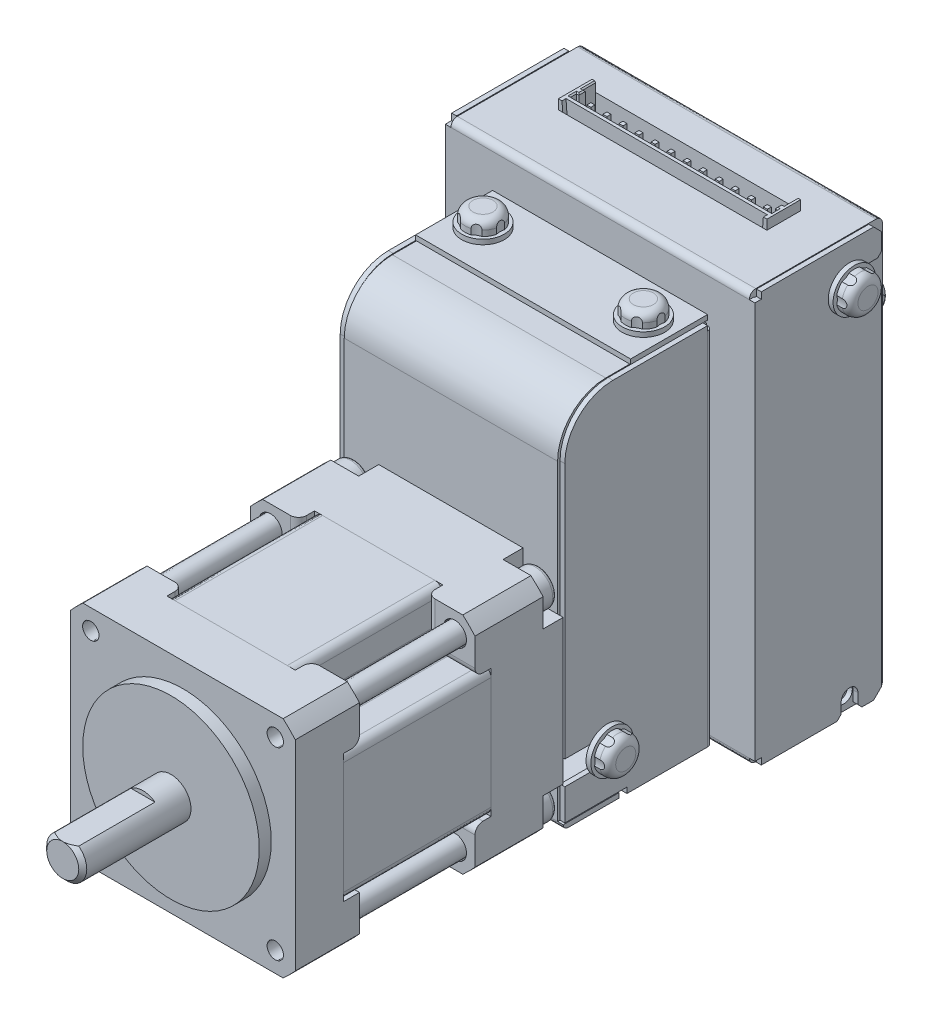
SolidWorks part; units mm, degrees
ref_plane "Front Plane" through (0, 0, 0) normal (0, 0, 1) x (1, 0, 0)
ref_plane "Top Plane" through (0, 0, 0) normal (0, 1, 0) x (1, 0, 0)
ref_plane "Right Plane" through (0, 0, 0) normal (1, 0, 0) x (0, 0, -1)
sketch "Sketch41" plane through (0, 0, 0) normal (0, 0, 1) x (1, 0, 0)
  circle A0 centre (0, 0) radius 11
  dimension "D1" = 22
extrude "Extrude21" add sketch "Sketch41" along normal blind 1.5
sketch "Sketch56" plane through (0, 0, 1.5) normal (0, 0, 1) x (1, 0, 0)
  circle A0 centre (0, 0) radius 2.5
  dimension "D1" = 5
extrude "Extrude33" add sketch "Sketch56" along normal blind 13.5
chamfer "Chamfer1" distance 0.5 angle 45
sketch "Sketch57" plane through (0, 0, 15) normal (0, 0, 1) x (1, 0, 0)
  line L0 (-1.5, 2) -> (1.5, 2)
  circle A0 centre (0, 0) radius 2.5 construction
  arc A1 (1.5, 2) -> (-1.5, 2) centre (0, 0) ccw
  dimension "D1" = 4.5
extrude "Cut-Extrude15" cut sketch "Sketch57" against normal blind 10
sketch "Sketch42" plane through (0, 0, 0) normal (0, 0, 1) x (1, 0, 0)
  line L1 (-12.48, 14) -> (12.48, 14)
  line L2 (-14, 12.48) -> (-14, -12.48)
  line L3 (-12.48, -14) -> (12.48, -14)
  line L4 (14, 12.48) -> (14, -12.48)
  line L6 (-14, 0) -> (14, 0) construction
  line L7 (0, 14) -> (0, -14) construction
  arc A0 (12.48, -14) -> (14, -12.48) centre (0, 0) ccw
  arc A1 (14, 12.48) -> (12.48, 14) centre (0, 0) ccw
  arc A2 (-12.48, 14) -> (-14, 12.48) centre (0, 0) ccw
  arc A3 (-14, -12.48) -> (-12.48, -14) centre (0, 0) ccw
  dimension "D3" = 37.51
  dimension "D1" = 28
  dimension "D2" = 28
extrude "Extrude22" add sketch "Sketch42" against normal blind 6 separate body
ref_plane "Length L" through (0, 0, -71) normal (0, 0, 1) x (1, 0, 0)
ref_plane "Plane10" through (0, 0, -52) normal (0, 0, 1) x (1, 0, 0)
ref_plane "Plane11" through (0, 0, -33.4) normal (0, 0, 1) x (1, 0, 0)
sketch "Sketch43" plane through (0, 0, -6) normal (0, 0, -1) x (-1, 0, 0)
  line L0 (-12.48, 14) -> (12.48, 14) construction
  line L1 (-8, 13) -> (-8, 10)
  line L2 (-10, 8) -> (-13, 8)
  line L3 (-14, -12.48) -> (-14, 12.48) construction
  line L4 (-14, 0) -> (14, 0) construction
  line L5 (14, 12.48) -> (14, -12.48) construction
  line L6 (0, 14) -> (0, -14) construction
  line L7 (12.48, -14) -> (-12.48, -14) construction
  line L8 (14, -12.48) -> (14, 12.48)
  line L9 (12.48, 14) -> (-12.48, 14)
  line L10 (-14, 12.48) -> (-14, -12.48)
  line L11 (-12.48, -14) -> (12.48, -14)
  line L12 (14, 12.48) -> (14, 8)
  line L13 (-7, 14) -> (-8, 14) construction
  line L14 (-14, 12.48) -> (-14, 8)
  line L15 (13, 8) -> (14, 8)
  line L16 (10, 8) -> (13, 8)
  line L17 (8, 13) -> (8, 10)
  line L18 (8, 14) -> (8, 13)
  line L19 (8, 14) -> (12.48, 14)
  line L20 (8, -14) -> (12.48, -14)
  line L21 (8, -14) -> (8, -13)
  line L22 (8, -13) -> (8, -10)
  line L23 (10, -8) -> (13, -8)
  line L24 (13, -8) -> (14, -8)
  line L25 (14, -12.48) -> (14, -8)
  line L26 (-8, 14) -> (-12.48, 14)
  line L27 (-14, 8) -> (-14, 7) construction
  line L28 (-8, 14) -> (-8, 13)
  line L29 (-13, 8) -> (-14, 8)
  line L30 (-14, -12.48) -> (-14, -8)
  line L31 (-13, -8) -> (-14, -8)
  line L32 (-10, -8) -> (-13, -8)
  line L33 (-8, -13) -> (-8, -10)
  line L34 (-8, -14) -> (-8, -13)
  line L35 (-8, -14) -> (-12.48, -14)
  arc A0 (-7, 14) -> (-8, 13) centre (-7, 13) ccw construction
  arc A1 (-8, 10) -> (-10, 8) centre (-10, 10) cw
  arc A2 (-13, 8) -> (-14, 7) centre (-13, 7) ccw construction
  arc A3 (8, 10) -> (10, 8) centre (10, 10) ccw
  arc A4 (12.48, 14) -> (14, 12.48) centre (0, 0) cw
  arc A5 (12.48, -14) -> (14, -12.48) centre (0, 0) ccw
  arc A6 (8, -10) -> (10, -8) centre (10, -10) cw
  arc A7 (12.48, -14) -> (14, -12.48) centre (0, 0) ccw
  arc A8 (14, 12.48) -> (12.48, 14) centre (0, 0) ccw
  arc A9 (-12.48, 14) -> (-14, 12.48) centre (0, 0) ccw
  arc A10 (-14, -12.48) -> (-12.48, -14) centre (0, 0) ccw
  arc A11 (-8, -10) -> (-10, -8) centre (-10, -10) ccw
  arc A12 (-12.48, -14) -> (-14, -12.48) centre (0, 0) cw
  arc A13 (-12.48, 14) -> (-14, 12.48) centre (0, 0) ccw
  dimension "D3" = 1
  dimension "D4" = 2
  dimension "D2" = 6
  dimension "D1" = 0
extrude "Extrude34" add sketch "Sketch43" along normal blind 2
hole_wizard "M2.5 Tapped Hole1" positions "Sketch59" profile "Sketch58" tap size "M2.5" standard "DIN"
sketch "Sketch59" plane through (0, 0, 0) normal (0, 0, 1) x (1, 0, 0)
  line L2 (11.5, 11.5) -> (-11.5, 11.5)
  line L3 (11.5, 11.5) -> (11.5, -11.5)
  line L4 (11.5, -11.5) -> (-11.5, -11.5)
  line L5 (-11.5, 11.5) -> (-11.5, -11.5)
  line L6 (11.5, 0) -> (-11.5, 0) construction
  line L8 (0, 11.5) -> (0, -11.5) construction
  point P87 (11.5, 11.5)
  point P89 (-11.5, 11.5)
  point P91 (11.5, -11.5)
  point P93 (-11.5, -11.5)
  dimension "D1" = 23
sketch "Sketch58" plane through (11.5, 11.5, 0) normal (1, 0, 0) x (0, -1, 0)
  line L0 (0, 0) -> (0, 8)
  line L1 (0, 8) -> (1.025, 8)
  line L2 (1.025, 8) -> (1.025, 0)
  line L5 (1.025, 0) -> (0, 0)
  line L11 (0, -6.35) -> (0, 107.95) construction
  dimension "Thru Tap Drill Dia." = 2.05
  dimension "Thru Tap Drill Depth" = 8
sketch "Sketch45" plane through (0, 0, -33.4) normal (0, 0, -1) x (-1, 0, 0)
  line L4 (-12.48, -14) -> (12.48, -14)
  line L5 (-14, 12.48) -> (-14, -12.48)
  line L6 (12.48, 14) -> (-12.48, 14)
  line L7 (14, -12.48) -> (14, 12.48)
  line L8 (-12.48, -14) -> (12.48, -14)
  line L9 (-14, 12.48) -> (-14, -12.48)
  line L10 (12.48, 14) -> (-12.48, 14)
  line L11 (14, -12.48) -> (14, 12.48)
  arc A4 (12.48, -14) -> (14, -12.48) centre (0, 0) ccw
  arc A5 (-14, -12.48) -> (-12.48, -14) centre (0, 0) ccw
  arc A6 (-12.48, 14) -> (-14, 12.48) centre (0, 0) ccw
  arc A7 (14, 12.48) -> (12.48, 14) centre (0, 0) ccw
  arc A8 (12.48, -14) -> (14, -12.48) centre (0, 0) ccw
  arc A9 (-14, -12.48) -> (-12.48, -14) centre (0, 0) ccw
  arc A10 (-12.48, 14) -> (-14, 12.48) centre (0, 0) ccw
  arc A11 (14, 12.48) -> (12.48, 14) centre (0, 0) ccw
  dimension "D1" = 0
extrude "Extrude24" add sketch "Sketch45" against normal blind 9 separate body
sketch "Sketch46" plane through (0, 0, -24.4) normal (0, 0, 1) x (1, 0, 0)
  line L4 (8, -14) -> (12.48, -14)
  line L5 (8, -10) -> (8, -14)
  line L6 (14, -8) -> (10, -8)
  line L7 (14, -12.48) -> (14, -8)
  line L8 (8, -14) -> (12.48, -14)
  line L9 (8, -10) -> (8, -14)
  line L10 (14, -8) -> (10, -8)
  line L11 (14, -12.48) -> (14, -8)
  line L12 (-14, -8) -> (-14, -12.48)
  line L13 (-10, -8) -> (-14, -8)
  line L14 (-8, -14) -> (-8, -10)
  line L15 (-12.48, -14) -> (-8, -14)
  line L16 (-14, -8) -> (-14, -12.48)
  line L17 (-10, -8) -> (-14, -8)
  line L18 (-8, -14) -> (-8, -10)
  line L19 (-12.48, -14) -> (-8, -14)
  line L20 (-8, 14) -> (-12.48, 14)
  line L21 (-8, 10) -> (-8, 14)
  line L22 (-14, 8) -> (-10, 8)
  line L23 (-14, 12.48) -> (-14, 8)
  line L24 (-8, 14) -> (-12.48, 14)
  line L25 (-8, 10) -> (-8, 14)
  line L26 (-14, 8) -> (-10, 8)
  line L27 (-14, 12.48) -> (-14, 8)
  line L28 (8, 14) -> (8, 10)
  line L29 (12.48, 14) -> (8, 14)
  line L30 (14, 8) -> (14, 12.48)
  line L31 (10, 8) -> (14, 8)
  line L32 (8, 14) -> (8, 10)
  line L33 (12.48, 14) -> (8, 14)
  line L34 (14, 8) -> (14, 12.48)
  line L35 (10, 8) -> (14, 8)
  arc A2 (12.48, -14) -> (14, -12.48) centre (0, 0) ccw
  arc A3 (10, -8) -> (8, -10) centre (10, -10) ccw
  arc A4 (12.48, -14) -> (14, -12.48) centre (0, 0) ccw
  arc A5 (10, -8) -> (8, -10) centre (10, -10) ccw
  arc A6 (-14, -12.48) -> (-12.48, -14) centre (0, 0) ccw
  arc A7 (-8, -10) -> (-10, -8) centre (-10, -10) ccw
  arc A8 (-14, -12.48) -> (-12.48, -14) centre (0, 0) ccw
  arc A9 (-8, -10) -> (-10, -8) centre (-10, -10) ccw
  arc A10 (-12.48, 14) -> (-14, 12.48) centre (0, 0) ccw
  arc A11 (-10, 8) -> (-8, 10) centre (-10, 10) ccw
  arc A12 (-12.48, 14) -> (-14, 12.48) centre (0, 0) ccw
  arc A13 (-10, 8) -> (-8, 10) centre (-10, 10) ccw
  arc A14 (14, 12.48) -> (12.48, 14) centre (0, 0) ccw
  arc A15 (8, 10) -> (10, 8) centre (10, 10) ccw
  arc A16 (14, 12.48) -> (12.48, 14) centre (0, 0) ccw
  arc A17 (8, 10) -> (10, 8) centre (10, 10) ccw
  dimension "D1" = 0
  dimension "D2" = 0
  dimension "D3" = 0
  dimension "D4" = 0
extrude "Extrude25" add sketch "Sketch46" along normal blind 2
hole_wizard "M2.5 Clearance Hole1" positions "Sketch61" profile "Sketch60" hole size "M2.5" standard "DIN"
sketch "Sketch61" plane through (0, 0, -33.4) normal (0, 0, -1) x (-1, 0, 0)
  point P34 (-11.5, -11.5)
  point P36 (-11.5, 11.5)
  point P38 (11.5, 11.5)
  point P40 (11.5, -11.5)
sketch "Sketch60" plane through (11.5, -11.5, -33.4) normal (1, 0, 0) x (0, 1, 0)
  line L0 (0, 0) -> (0, 48.4)
  line L1 (0, 48.4) -> (1.45, 48.4)
  line L2 (1.45, 48.4) -> (1.45, 0)
  line L5 (1.45, 0) -> (0, 0)
  line L11 (0, -6.35) -> (0, 107.95) construction
  dimension "Thru Hole Dia." = 2.9
  dimension "Thru Hole Depth" = 48.4
sketch "Sketch62" plane through (0, 0, -33.4) normal (0, 0, -1) x (-1, 0, 0)
  line L0 (-9, 14) -> (-9, 10)
  line L2 (-10, 9) -> (-14, 9)
  line L4 (-8.6938, 0) -> (8.6938, 0) construction
  line L5 (0, 8.2864) -> (0, -8.2864) construction
  line L6 (-9, 14) -> (-12.48, 14)
  line L7 (-14, 12.48) -> (-14, 9)
  line L8 (14, 12.48) -> (14, 9)
  line L9 (9, 14) -> (12.48, 14)
  line L10 (10, 9) -> (14, 9)
  line L11 (9, 14) -> (9, 10)
  line L12 (9, -14) -> (9, -10)
  line L13 (10, -9) -> (14, -9)
  line L14 (9, -14) -> (12.48, -14)
  line L15 (14, -12.48) -> (14, -9)
  line L16 (-14, -12.48) -> (-14, -9)
  line L17 (-9, -14) -> (-12.48, -14)
  line L18 (-10, -9) -> (-14, -9)
  line L19 (-9, -14) -> (-9, -10)
  line L20 (-14, 12.48) -> (-14, -12.48) construction
  arc A0 (-9, 10) -> (-10, 9) centre (-10, 10) cw
  arc A2 (-12.48, 14) -> (-14, 12.48) centre (0, 0) ccw
  arc A3 (12.48, 14) -> (14, 12.48) centre (0, 0) cw
  arc A4 (9, 10) -> (10, 9) centre (10, 10) ccw
  arc A5 (9, -10) -> (10, -9) centre (10, -10) cw
  arc A6 (12.48, -14) -> (14, -12.48) centre (0, 0) ccw
  arc A7 (-12.48, -14) -> (-14, -12.48) centre (0, 0) cw
  arc A8 (-9, -10) -> (-10, -9) centre (-10, -10) ccw
  dimension "D1" = 5
extrude "Cut-Extrude16" cut sketch "Sketch62" against normal blind 2.5
sketch "Sketch47" plane through (0, 0, -6) normal (0, 0, -1) x (-1, 0, 0)
  line L0 (-10, 8) -> (-13, 8) construction
  line L1 (-8, 13) -> (-8, 10) construction
  line L2 (-10, 8) -> (-13, 8)
  line L3 (-8, 13) -> (-8, 10)
  line L5 (-14, 0) -> (14, 0) construction
  line L6 (-14, 0) -> (14, 0) construction
  line L9 (0, 9.7532) -> (0, -9.7532) construction
  line L10 (8, 13) -> (8, 10)
  line L11 (10, 8) -> (13, 8)
  line L12 (10, -8) -> (13, -8)
  line L13 (8, -13) -> (8, -10)
  line L14 (-8, -13) -> (-8, -10)
  line L15 (-10, -8) -> (-13, -8)
  line L16 (-7, 14) -> (7, 14)
  line L17 (-14, 7) -> (-14, -7)
  line L18 (14, 7) -> (14, -7)
  line L19 (-7, -14) -> (7, -14)
  arc A0 (-10, 8) -> (-8, 10) centre (-10, 10) ccw construction
  arc A1 (-7, 14) -> (-8, 13) centre (-7, 13) ccw construction
  arc A2 (-13, 8) -> (-14, 7) centre (-13, 7) ccw construction
  arc A3 (-7, 14) -> (-8, 13) centre (-7, 13) ccw
  arc A4 (-13, 8) -> (-14, 7) centre (-13, 7) ccw
  arc A5 (-10, 8) -> (-8, 10) centre (-10, 10) ccw
  arc A6 (10, 8) -> (8, 10) centre (10, 10) cw
  arc A7 (13, 8) -> (14, 7) centre (13, 7) cw
  arc A8 (7, 14) -> (8, 13) centre (7, 13) cw
  arc A9 (7, -14) -> (8, -13) centre (7, -13) ccw
  arc A10 (13, -8) -> (14, -7) centre (13, -7) ccw
  arc A11 (10, -8) -> (8, -10) centre (10, -10) ccw
  arc A12 (-10, -8) -> (-8, -10) centre (-10, -10) cw
  arc A13 (-13, -8) -> (-14, -7) centre (-13, -7) cw
  arc A14 (-7, -14) -> (-8, -13) centre (-7, -13) cw
extrude "Extrude26" add sketch "Sketch47" along normal up to surface (18.4 mm away) separate body
fillet "Fillet26" radius 1
fillet "Fillet27" radius 1
sketch "Sketch48" plane through (0, 0, 0) normal (1, 0, 0) x (0, 0, -1)
  line L1 (33.4, 25.5) -> (33.4, -14)
  line L2 (39.4, 31.5) -> (52, 31.5)
  line L3 (52, 31.5) -> (52, -14)
  line L4 (33.4, -14) -> (51.3, -14)
  line L5 (51.4, 30.9) -> (51.4, -13.4)
  line L6 (39.4, 30.9) -> (51.4, 30.9)
  line L7 (34, 25.5) -> (34, -13.4)
  line L8 (34, -13.4) -> (51.3, -13.4)
  line L9 (33.4, -14) -> (51.4, -14) construction
  line L10 (52, 31.5) -> (52, -13.4) construction
  line L12 (52, 20.955) -> (52, -20.955) construction
  line L14 (22.4, -14) -> (30.9, -14) construction
  line L15 (33.4, -9) -> (33.4, 9) construction
  line L16 (22.4, 14) -> (30.9, 14) construction
  line L17 (51.3, -13.4) -> (51.3, -14)
  line L18 (34, -13.4) -> (51.4, -13.4) construction
  line L19 (51.4, -13.4) -> (51.4, -14)
  line L20 (51.4, -14) -> (52, -14)
  arc A0 (33.4, 25.5) -> (39.4, 31.5) centre (39.4, 25.5) cw
  arc A1 (34, 25.5) -> (39.4, 30.9) centre (39.4, 25.5) cw
  dimension "D2" = 6
  dimension "D3" = 17.5
  dimension "D4" = 0.1
  dimension "D1" = 0.6
extrude "Extrude27" add sketch "Sketch48" along normal mid plane 26.6 separate body
sketch "Sketch50" plane through (14, 0, 0) normal (1, 0, 0) x (0, 0, -1)
  line L0 (52, 31.5) -> (39.4, 31.5) construction
  line L3 (51.4, 31.5) -> (39.6, 31.5)
  line L4 (52, -14) -> (52, 30.9)
  line L5 (41.35, -14) -> (52, -14)
  line L6 (33.6, 25.5) -> (33.6, -6.4)
  line L7 (41.35, -14) -> (41.35, -13.3)
  line L9 (41.35, -13.3) -> (33.6, -13.3)
  line L11 (33.4, 25.5) -> (33.4, -14) construction
  line L12 (33.6, -9.4) -> (38.9, -9.4)
  line L13 (38.9, -6.4) -> (33.6, -6.4)
  line L14 (33.6, -9.4) -> (33.6, -13.3)
  line L15 (51.4, -14) -> (51.4, 30.9) construction
  line L16 (51.4, 31.5) -> (51.4, 30.9)
  line L17 (51.4, 30.9) -> (39.4, 30.9) construction
  line L18 (51.4, 30.9) -> (52, 30.9)
  arc A0 (33.6, 25.5) -> (39.6, 31.5) centre (39.6, 25.5) cw
  arc A1 (38.9, -9.4) -> (38.9, -6.4) centre (38.9, -7.9) ccw
  dimension "D1" = 6
  dimension "D2" = 0.7
  dimension "D3" = 7.95
  dimension "D4" = 0.2
  dimension "D5" = 3
  dimension "D6" = 5.3
  dimension "D7" = 6.1
extrude "Extrude28" add sketch "Sketch50" against normal blind 0.6
sketch "Sketch51" plane through (13.3, 0, 0) normal (1, 0, 0) x (0, 0, -1)
  line L0 (52, -14) -> (52, 31.5) construction
  line L2 (52, -14) -> (52, 30.9)
  line L3 (52, 30.9) -> (51.4, 30.9)
  line L4 (51.4, -14) -> (51.4, 30.9) construction
  line L5 (51.4, -14) -> (51.4, 30.9)
  line L7 (51.4, -14) -> (52, -14)
  line L8 (52, 30.9) -> (51.4, 30.9) construction
extrude "Extrude29" add sketch "Sketch51" along normal up to surface (0.1 mm away)
sketch "Sketch52" plane through (-14, 0, 0) normal (-1, 0, 0) x (0, 0, 1)
  line L6 (-52, 30.9) -> (-52, -14)
  line L7 (-39.6, 31.5) -> (-51.4, 31.5)
  line L8 (-33.6, -6.4) -> (-33.6, 25.5)
  line L9 (-41.35, -13.3) -> (-33.6, -13.3)
  line L10 (-41.35, -14) -> (-41.35, -13.3)
  line L11 (-52, -14) -> (-41.35, -14)
  line L12 (-52, 30.9) -> (-52, -14)
  line L13 (-39.6, 31.5) -> (-51.4, 31.5)
  line L14 (-33.6, -13.3) -> (-33.6, 25.5)
  line L15 (-41.35, -13.3) -> (-33.6, -13.3)
  line L16 (-41.35, -14) -> (-41.35, -13.3)
  line L17 (-52, -14) -> (-41.35, -14)
  line L21 (-38.9, -6.4) -> (-33.6, -6.4)
  line L23 (-33.6, -9.4) -> (-38.9, -9.4)
  line L25 (-33.6, -13.3) -> (-33.6, -9.4)
  line L26 (-51.4, 30.9) -> (-52, 30.9)
  line L27 (-51.4, 30.9) -> (-52, 30.9)
  line L28 (-51.4, 31.5) -> (-51.4, 30.9)
  line L29 (-51.4, 31.5) -> (-51.4, 30.9)
  arc A1 (-33.6, 25.5) -> (-39.6, 31.5) centre (-39.6, 25.5) ccw
  arc A2 (-33.6, 25.5) -> (-39.6, 31.5) centre (-39.6, 25.5) ccw
  arc A4 (-38.9, -6.4) -> (-38.9, -9.4) centre (-38.9, -7.9) ccw
  dimension "D1" = 0
extrude "Extrude30" add sketch "Sketch52" against normal blind 0.6
sketch "Sketch53" plane through (-13.3, 0, 0) normal (-1, 0, 0) x (0, 0, 1)
  line L4 (-52, 30.9) -> (-52, -14)
  line L5 (-51.4, 30.9) -> (-52, 30.9)
  line L6 (-51.4, -14) -> (-51.4, 30.9)
  line L7 (-52, -14) -> (-51.4, -14)
  line L8 (-52, 30.9) -> (-52, -14)
  line L9 (-51.4, 30.9) -> (-52, 30.9)
  line L10 (-51.4, -14) -> (-51.4, 30.9)
  line L11 (-52, -14) -> (-51.4, -14)
  dimension "D1" = 0
extrude "Extrude31" add sketch "Sketch53" along normal up to surface (0.1 mm away)
fillet "Fillet24" radius 0.6 1 edges at (-14, 8.45, -52)
sketch "Sketch55" plane through (0, 0, 0) normal (1, 0, 0) x (0, 0, -1)
  line L0 (33.4, 25.5) -> (33.4, -14) construction
  line L1 (34, -13.4) -> (51.3, -13.4) construction
  line L2 (33.4, -14) -> (51.3, -14) construction
  line L3 (33.4, -13.4) -> (33.4, -14)
  line L4 (33.4, -13.4) -> (40.35, -13.4)
  line L5 (33.4, -14) -> (40.35, -14)
  line L6 (40.35, -14) -> (40.35, -13.4)
  dimension "D1" = 6.95
extrude "Extrude32" add sketch "Sketch55" along normal up to surface and the other way up to surface
fillet "Fillet25" radius 0.6 1 edges at (0, -14, -33.4)
fillet "Fillet30" radius 0.6
sketch "Sketch63" plane through (0, 0, -8) normal (0, 0, -1) x (-1, 0, 0)
  circle A0 centre (-11.5, 11.5) radius 1.3
  circle A1 centre (11.5, 11.5) radius 1.3
  circle A2 centre (-11.5, -11.5) radius 1.3
  circle A3 centre (11.5, -11.5) radius 1.3
  dimension "D1" = 2.6
extrude "Extrude35" add sketch "Sketch63" against normal blind 5 and the other way up to surface separate body
sketch "Sketch64" plane through (0, 0, -30.9) normal (0, 0, -1) x (-1, 0, 0)
  circle A0 centre (-11.5, -11.5) radius 2.2
  circle A1 centre (-11.5, 11.5) radius 2.2
  circle A2 centre (11.5, 11.5) radius 2.2
  circle A3 centre (11.5, -11.5) radius 2.2
  dimension "D1" = 4.4
extrude "Extrude36" add sketch "Sketch64" along normal blind 2 separate body
fillet "Fillet31" radius 0.5 1 edges at (-13.7, 11.5, -32.9)
fillet "Fillet32" radius 0.5
fillet "Fillet33" radius 0.5
fillet "Fillet34" radius 0.5
sketch "Sketch65" plane through (14, 0, 0) normal (1, 0, 0) x (0, 0, -1)
  circle A0 centre (38.9, -7.9) radius 2.65
  dimension "D1" = 5.3
extrude "Extrude37" add sketch "Sketch65" along normal blind 0.6 separate body
sketch "Sketch66" plane through (14.6, 0, 0) normal (1, 0, 0) x (0, 0, -1)
  circle A0 centre (38.9, -7.9) radius 2.25
  dimension "D1" = 4.5
extrude "Extrude38" add sketch "Sketch66" along normal blind 1.7 separate body
fillet "Fillet35" radius 1 1 edges at (16.3, -5.65, -38.9)
sketch "Sketch67" plane through (16.3, 0, 0) normal (1, 0, 0) x (0, 0, -1)
  line L0 (36.78, -7.9) -> (36.65, -7.9) construction
  line L1 (40.835, -4.5485) -> (36.965, -4.5485) construction
  line L2 (36.965, -4.5485) -> (35.03, -7.9) construction
  line L3 (35.03, -7.9) -> (36.965, -11.2515) construction
  line L4 (36.965, -11.2515) -> (40.835, -11.2515) construction
  line L5 (40.835, -11.2515) -> (42.77, -7.9) construction
  line L6 (42.77, -7.9) -> (40.835, -4.5485) construction
  circle A0 centre (38.9, -7.9) radius 3.3515 construction
  circle A1 centre (42.77, -7.9) radius 1.75
  circle A2 centre (40.835, -4.5485) radius 1.75
  circle A3 centre (36.965, -4.5485) radius 1.75
  circle A4 centre (35.03, -7.9) radius 1.75
  circle A5 centre (36.965, -11.2515) radius 1.75
  circle A6 centre (40.835, -11.2515) radius 1.75
  circle A7 centre (38.9, -7.9) radius 2.25 construction
  dimension "D1" = 3.5
  dimension "D2" = 0.13
extrude "Cut-Extrude17" cut sketch "Sketch67" against normal up to surface (1.7 mm away)
sketch "Sketch68" plane through (0, 0, 0) normal (1, 0, 0) x (0, 0, -1)
  line L0 (52, 30.9) -> (52, -14) construction
  line L1 (52, 36.3) -> (52, -13.2)
  line L3 (41.35, -14) -> (51.4, -14) construction
  line L4 (52.8, 37.1) -> (67.8, 37.1)
  line L6 (52.8, -14) -> (67.8, -14)
  line L8 (68.6, -13.2) -> (68.6, 36.3)
  arc A0 (52, -13.2) -> (52.8, -14) centre (52.8, -13.2) ccw
  arc A1 (67.8, -14) -> (68.6, -13.2) centre (67.8, -13.2) ccw
  arc A2 (52, 36.3) -> (52.8, 37.1) centre (52.8, 36.3) cw
  arc A3 (68.6, 36.3) -> (67.8, 37.1) centre (67.8, 36.3) ccw
  dimension "D1" = 0.8
  dimension "D9" = 0.8
  dimension "D2" = 0.8
  dimension "D4" = 16.6
  dimension "D6" = 51.1
extrude "Extrude39" add sketch "Sketch68" along normal mid plane 37.2 separate body
sketch "Sketch69" plane through (18.6, 0, 0) normal (1, 0, 0) x (0, 0, -1)
  line L0 (52, 36.3) -> (52, -13.2) construction
  line L1 (52, 36.3) -> (52, -13.2)
  line L2 (52, 36.3) -> (52.6, 36.3)
  line L3 (52.6, 36.3) -> (52.6, -13.2)
  line L4 (52.6, -13.2) -> (52, -13.2)
  dimension "D1" = 0.6
extrude "Extrude40" add sketch "Sketch69" along normal blind 0.1
sketch "Sketch70" plane through (18.7, 0, 0) normal (1, 0, 0) x (0, 0, -1)
  line L0 (66.8, -14) -> (67.8, -13)
  line L1 (65.35, -14) -> (64.85, -13.5)
  line L2 (64.85, -13.5) -> (64.85, -12.2)
  line L3 (62.75, -12.2) -> (62.75, -13.5)
  line L4 (52.6, 36.3) -> (52, 36.3)
  line L5 (52, 36.3) -> (52, -13.2)
  line L6 (52, -13.2) -> (52.6, -13.2)
  line L7 (52.6, -13.2) -> (52.6, 36.3)
  line L8 (52.8, 36.3) -> (52, 36.3)
  line L9 (52, 36.3) -> (52, -13.2)
  line L10 (52.8, -14) -> (62.25, -14)
  line L11 (67.8, -13) -> (67.8, 30.2)
  line L12 (62.75, -13.5) -> (62.25, -14)
  line L13 (65.35, -14) -> (66.8, -14)
  line L14 (67.3, 33.5) -> (67.8, 34)
  line L15 (52, -13.2) -> (52.6, -13.2) construction
  line L16 (52.8, -13.2) -> (52.8, -14)
  line L17 (52, -13.2) -> (52.8, -13.2)
  line L18 (52.8, -14) -> (67.8, -14) construction
  line L19 (52.8, 37.1) -> (52.8, 36.3)
  line L20 (67.8, 37.1) -> (52.8, 37.1) construction
  line L21 (66.8, 37.1) -> (52.8, 37.1)
  line L22 (66.8, 37.1) -> (67.8, 36.1)
  line L23 (67.3, 30.7) -> (67.8, 30.2)
  line L24 (67.3, 33.5) -> (63.8, 33.5)
  line L25 (63.8, 30.7) -> (67.3, 30.7)
  line L27 (67.8, 34) -> (67.8, 36.1)
  arc A0 (64.85, -12.2) -> (62.75, -12.2) centre (63.8, -12.2) ccw
  arc A1 (63.8, 33.5) -> (63.8, 30.7) centre (63.8, 32.1) ccw
  dimension "D2" = 15.8
  dimension "D3" = 45
  dimension "D4" = 45
  dimension "D5" = 2.1
  dimension "D6" = 0.5
  dimension "D7" = 45
  dimension "D8" = 1
  dimension "D9" = 1.8
  dimension "D10" = 11.8
  dimension "D11" = 45
  dimension "D12" = 45
  dimension "D13" = 2.8
  dimension "D14" = 4
  dimension "D15" = 5
  dimension "D16" = 45
  dimension "D17" = 1
  dimension "D18" = 0.5
  dimension "D1" = 0
extrude "Extrude41" add sketch "Sketch70" along normal blind 0.6
sketch "Sketch71" plane through (-18.6, 0, 0) normal (-1, 0, 0) x (0, 0, 1)
  line L4 (-52, -13.2) -> (-52, 36.3)
  line L5 (-52.6, -13.2) -> (-52, -13.2)
  line L6 (-52.6, 36.3) -> (-52.6, -13.2)
  line L7 (-52, 36.3) -> (-52.6, 36.3)
  line L8 (-52, -13.2) -> (-52, 36.3)
  line L9 (-52.6, -13.2) -> (-52, -13.2)
  line L10 (-52.6, 36.3) -> (-52.6, -13.2)
  line L11 (-52, 36.3) -> (-52.6, 36.3)
  dimension "D1" = 0
extrude "Extrude42" add sketch "Sketch71" along normal blind 0.1
sketch "Sketch72" plane through (-18.7, 0, 0) normal (-1, 0, 0) x (0, 0, 1)
  line L20 (-67.3, 30.7) -> (-67.8, 30.2)
  line L21 (-67.8, 30.2) -> (-67.8, -13)
  line L22 (-67.8, -13) -> (-66.8, -14)
  line L23 (-66.8, -14) -> (-65.35, -14)
  line L24 (-65.35, -14) -> (-64.85, -13.5)
  line L25 (-64.85, -13.5) -> (-64.85, -12.2)
  line L26 (-62.75, -12.2) -> (-62.75, -13.5)
  line L27 (-62.75, -13.5) -> (-62.25, -14)
  line L28 (-62.25, -14) -> (-52.8, -14)
  line L29 (-52.8, -14) -> (-52.8, -13.2)
  line L30 (-52.8, -13.2) -> (-52, -13.2)
  line L31 (-52, -13.2) -> (-52, 36.3)
  line L32 (-52, 36.3) -> (-52.8, 36.3)
  line L33 (-52.8, 36.3) -> (-52.8, 37.1)
  line L34 (-52.8, 37.1) -> (-66.8, 37.1)
  line L35 (-66.8, 37.1) -> (-67.8, 36.1)
  line L36 (-67.8, 36.1) -> (-67.8, 34)
  line L37 (-67.8, 34) -> (-67.3, 33.5)
  line L38 (-67.3, 33.5) -> (-63.8, 33.5)
  line L39 (-63.8, 30.7) -> (-67.3, 30.7)
  line L40 (-67.3, 30.7) -> (-67.8, 30.2)
  line L41 (-67.8, 30.2) -> (-67.8, -13)
  line L42 (-67.8, -13) -> (-66.8, -14)
  line L43 (-66.8, -14) -> (-65.35, -14)
  line L44 (-65.35, -14) -> (-64.85, -13.5)
  line L45 (-64.85, -13.5) -> (-64.85, -12.2)
  line L46 (-62.75, -12.2) -> (-62.75, -13.5)
  line L47 (-62.75, -13.5) -> (-62.25, -14)
  line L48 (-62.25, -14) -> (-52.8, -14)
  line L49 (-52.8, -14) -> (-52.8, -13.2)
  line L50 (-52.8, -13.2) -> (-52, -13.2)
  line L51 (-52, -13.2) -> (-52, 36.3)
  line L52 (-52, 36.3) -> (-52.8, 36.3)
  line L53 (-52.8, 36.3) -> (-52.8, 37.1)
  line L54 (-52.8, 37.1) -> (-66.8, 37.1)
  line L55 (-66.8, 37.1) -> (-67.8, 36.1)
  line L56 (-67.8, 36.1) -> (-67.8, 34)
  line L57 (-67.8, 34) -> (-67.3, 33.5)
  line L58 (-67.3, 33.5) -> (-63.8, 33.5)
  line L59 (-63.8, 30.7) -> (-67.3, 30.7)
  arc A2 (-62.75, -12.2) -> (-64.85, -12.2) centre (-63.8, -12.2) ccw
  arc A3 (-63.8, 30.7) -> (-63.8, 33.5) centre (-63.8, 32.1) ccw
  arc A4 (-62.75, -12.2) -> (-64.85, -12.2) centre (-63.8, -12.2) ccw
  arc A5 (-63.8, 30.7) -> (-63.8, 33.5) centre (-63.8, 32.1) ccw
  dimension "D1" = 0
extrude "Extrude43" add sketch "Sketch72" along normal blind 0.6
sketch "Sketch73" plane through (18.6, 0, 0) normal (1, 0, 0) x (0, 0, -1)
  arc A0 (64.85, -12.2) -> (62.75, -12.2) centre (63.8, -12.2) ccw construction
  circle A1 centre (63.8, -12.2) radius 1.05
extrude "Cut-Extrude18" cut sketch "Sketch73" against normal blind 0.6
sketch "Sketch74" plane through (19.3, 0, 0) normal (1, 0, 0) x (0, 0, -1)
  circle A0 centre (63.8, 32.1) radius 2.65
  dimension "D1" = 5.3
extrude "Extrude44" add sketch "Sketch74" along normal blind 0.6 separate body
sketch "Sketch75" plane through (19.9, 0, 0) normal (1, 0, 0) x (0, 0, -1)
  circle A0 centre (63.8, 32.1) radius 2.25
  dimension "D1" = 4.5
extrude "Extrude45" add sketch "Sketch75" along normal blind 1.7 separate body
fillet "Fillet36" radius 1 1 edges at (21.6, 32.1, -66.05)
sketch "Sketch76" plane through (21.6, 0, 0) normal (1, 0, 0) x (0, 0, -1)
  line L0 (65.4758, 35.0025) -> (64.86, 33.936) construction
  line L1 (59.93, 32.1) -> (61.865, 28.7485) construction
  line L2 (61.865, 28.7485) -> (65.735, 28.7485) construction
  line L3 (65.735, 28.7485) -> (67.67, 32.1) construction
  line L4 (67.67, 32.1) -> (65.735, 35.4515) construction
  line L5 (65.735, 35.4515) -> (61.865, 35.4515) construction
  line L6 (61.865, 35.4515) -> (59.93, 32.1) construction
  circle A0 centre (63.8, 32.1) radius 3.3515 construction
  circle A1 centre (61.865, 28.7485) radius 1.75
  circle A2 centre (59.93, 32.1) radius 1.75
  circle A3 centre (61.865, 35.4515) radius 1.75
  circle A4 centre (65.735, 35.4515) radius 1.75
  circle A5 centre (67.67, 32.1) radius 1.75
  circle A6 centre (65.735, 28.7485) radius 1.75
  circle A7 centre (63.8, 32.1) radius 2.25 construction
  point P17 (64.925, 34.0486)
  dimension "D1" = 3.5
  dimension "D2" = 0.13
extrude "Cut-Extrude19" cut sketch "Sketch76" against normal up to surface (1.7 mm away)
sketch "Sketch77" plane through (-18.6, 0, 0) normal (-1, 0, 0) x (0, 0, 1)
  arc A0 (-62.75, -12.2) -> (-64.85, -12.2) centre (-63.8, -12.2) ccw construction
  circle A1 centre (-63.8, -12.2) radius 1.05
extrude "Cut-Extrude20" cut sketch "Sketch77" against normal blind 0.6
sketch "Sketch78" plane through (-19.3, 0, 0) normal (-1, 0, 0) x (0, 0, 1)
  circle A0 centre (-63.8, 32.1) radius 2.65 construction
  circle A1 centre (-63.8, 32.1) radius 2.65
extrude "Extrude46" add sketch "Sketch78" along normal blind 0.6 separate body
sketch "Sketch79" plane through (-19.9, 0, 0) normal (-1, 0, 0) x (0, 0, 1)
  circle A1 centre (-63.8, 32.1) radius 2.25
  circle A2 centre (-63.8, 32.1) radius 2.25
  dimension "D1" = 0
extrude "Extrude47" add sketch "Sketch79" along normal blind 1.7 separate body
fillet "Fillet37" radius 1 1 edges at (-21.6, 32.1, -61.55)
sketch "Sketch80" plane through (-21.6, 0, 0) normal (-1, 0, 0) x (0, 0, 1)
  circle A1 centre (-65.735, 28.7485) radius 1.75
  circle A2 centre (-65.735, 28.7485) radius 1.75
  circle A3 centre (-67.67, 32.1) radius 1.75
  circle A4 centre (-67.67, 32.1) radius 1.75
  circle A5 centre (-65.735, 35.4515) radius 1.75
  circle A6 centre (-65.735, 35.4515) radius 1.75
  circle A7 centre (-61.865, 35.4515) radius 1.75
  circle A8 centre (-61.865, 35.4515) radius 1.75
  circle A9 centre (-59.93, 32.1) radius 1.75
  circle A10 centre (-59.93, 32.1) radius 1.75
  circle A11 centre (-61.865, 28.7485) radius 1.75
  circle A12 centre (-61.865, 28.7485) radius 1.75
  dimension "D1" = 0
  dimension "D2" = 0
  dimension "D3" = 0
  dimension "D4" = 0
  dimension "D5" = 0
  dimension "D6" = 0
extrude "Cut-Extrude21" cut sketch "Sketch80" against normal up to surface (1.7 mm away)
sketch "Sketch81" plane through (0, 0, -68.6) normal (0, 0, -1) x (-1, 0, 0)
  line L0 (-18.6, -14) -> (18.6, -14) construction
  circle A0 centre (-15, 26.6) radius 2.65
  circle A1 centre (15, -3.4) radius 2.65
  dimension "D2" = 40.6
  dimension "D3" = 15
  dimension "D4" = 15
  dimension "D5" = 5.3
  dimension "D1" = 10.6
extrude "Extrude48" add sketch "Sketch81" along normal blind 0.6 separate body
sketch "Sketch82" plane through (0, 0, -69.2) normal (0, 0, -1) x (-1, 0, 0)
  circle A0 centre (-15, 26.6) radius 2.25
  circle A1 centre (15, -3.4) radius 2.25
  dimension "D1" = 4.5
extrude "Extrude49" add sketch "Sketch82" along normal blind 1.7 separate body
fillet "Fillet38" radius 1 1 edges at (12.75, 26.6, -70.9)
fillet "Fillet39" radius 1
sketch "Sketch83" plane through (0, 0, -70.9) normal (0, 0, -1) x (-1, 0, 0)
  line L0 (-16.935, 29.9515) -> (-16.06, 28.436) construction
  line L1 (-11.13, 26.6) -> (-13.065, 29.9515) construction
  line L2 (-13.065, 29.9515) -> (-16.935, 29.9515) construction
  line L3 (-16.935, 29.9515) -> (-18.87, 26.6) construction
  line L4 (-18.87, 26.6) -> (-16.935, 23.2485) construction
  line L5 (-16.935, 23.2485) -> (-13.065, 23.2485) construction
  line L6 (-13.065, 23.2485) -> (-11.13, 26.6) construction
  line L7 (16.935, -6.7515) -> (18.87, -3.4) construction
  line L8 (18.87, -3.4) -> (16.935, -0.0485) construction
  line L9 (16.935, -0.0485) -> (13.065, -0.0485) construction
  line L10 (13.065, -0.0485) -> (11.13, -3.4) construction
  line L11 (11.13, -3.4) -> (13.065, -6.7515) construction
  line L12 (13.065, -6.7515) -> (16.935, -6.7515) construction
  circle A0 centre (-15, 26.6) radius 3.3515 construction
  circle A1 centre (15, -3.4) radius 3.3515 construction
  circle A2 centre (-18.87, 26.6) radius 1.75
  circle A3 centre (-16.935, 23.2485) radius 1.75
  circle A4 centre (-13.065, 23.2485) radius 1.75
  circle A5 centre (-11.13, 26.6) radius 1.75
  circle A6 centre (-13.065, 29.9515) radius 1.75
  circle A7 centre (-16.935, 29.9515) radius 1.75
  circle A8 centre (13.065, -0.0485) radius 1.75
  circle A9 centre (11.13, -3.4) radius 1.75
  circle A10 centre (13.065, -6.7515) radius 1.75
  circle A11 centre (16.935, -6.7515) radius 1.75
  circle A12 centre (18.87, -3.4) radius 1.75
  circle A13 centre (16.935, -0.0485) radius 1.75
  circle A14 centre (-15, 26.6) radius 2.25 construction
  point P30 (-16.125, 28.5486)
  dimension "D1" = 3.5
  dimension "D2" = 0.13
extrude "Cut-Extrude22" cut sketch "Sketch83" against normal up to surface (1.7 mm away)
sketch "Sketch85" plane through (0, 0, 0) normal (1, 0, 0) x (0, 0, -1)
  line L0 (51.4, 31.5) -> (39.6, 31.5) construction
  line L1 (52, 36.3) -> (52, -13.2) construction
  line L2 (52, 31.5) -> (42.4, 31.5)
  line L3 (52, 32.1) -> (52, 31.5)
  line L4 (52, 32.1) -> (42.4, 32.1)
  line L5 (42.4, 32.1) -> (42.4, 31.5)
  dimension "D1" = 9.6
  dimension "D2" = 0.6
extrude "Extrude50" add sketch "Sketch85" against normal up to vertex and the other way up to vertex separate body
sketch "Sketch86" plane through (0, 32.1, 0) normal (0, 1, 0) x (1, 0, 0)
  line L0 (-13.4, 52) -> (13.4, 52) construction
  line L1 (-10, 47.4) -> (10, 47.4) construction
  line L2 (0, -58.905) -> (0, 58.905) construction
  circle A0 centre (-10, 47.4) radius 2.65
  circle A1 centre (10, 47.4) radius 2.65
  point P7 (0, 47.4)
  dimension "D1" = 10
  dimension "D2" = 5.3
  dimension "D3" = 4.6
extrude "Extrude51" add sketch "Sketch86" along normal blind 0.6 separate body
sketch "Sketch87" plane through (0, 32.7, 0) normal (0, 1, 0) x (1, 0, 0)
  circle A0 centre (-10, 47.4) radius 2.25
  circle A1 centre (10, 47.4) radius 2.25
  dimension "D1" = 4.5
extrude "Extrude52" add sketch "Sketch87" along normal blind 1.7 separate body
fillet "Fillet40" radius 1 1 edges at (-10, 34.4, -45.15)
fillet "Fillet41" radius 1
sketch "Sketch88" plane through (0, 34.4, 0) normal (0, 1, 0) x (1, 0, 0)
  line L0 (-8.94, 49.236) -> (-8.065, 50.7515) construction
  line L1 (-6.13, 47.4) -> (-8.065, 50.7515) construction
  line L2 (-8.065, 50.7515) -> (-11.935, 50.7515) construction
  line L3 (-11.935, 50.7515) -> (-13.87, 47.4) construction
  line L4 (-13.87, 47.4) -> (-11.935, 44.0485) construction
  line L5 (-11.935, 44.0485) -> (-8.065, 44.0485) construction
  line L6 (-8.065, 44.0485) -> (-6.13, 47.4) construction
  line L7 (8.065, 44.0485) -> (11.935, 44.0485) construction
  line L8 (11.935, 44.0485) -> (13.87, 47.4) construction
  line L9 (13.87, 47.4) -> (11.935, 50.7515) construction
  line L10 (11.935, 50.7515) -> (8.065, 50.7515) construction
  line L11 (8.065, 50.7515) -> (6.13, 47.4) construction
  line L12 (6.13, 47.4) -> (8.065, 44.0485) construction
  circle A0 centre (-10, 47.4) radius 3.3515 construction
  circle A1 centre (10, 47.4) radius 3.3515 construction
  arc A2 (-13.2135, 49.5565) -> (-10.2609, 51.2612) centre (-11.935, 50.7515) ccw
  arc A3 (-9.7391, 51.2612) -> (-6.7865, 49.5565) centre (-8.065, 50.7515) ccw
  arc A4 (-6.5257, 49.1047) -> (-6.5257, 45.6953) centre (-6.13, 47.4) ccw
  arc A5 (-6.7865, 45.2435) -> (-9.7391, 43.5388) centre (-8.065, 44.0485) ccw
  arc A6 (-10.2609, 43.5388) -> (-13.2135, 45.2435) centre (-11.935, 44.0485) ccw
  arc A7 (-13.4743, 45.6953) -> (-13.4743, 49.1047) centre (-13.87, 47.4) ccw
  arc A8 (6.5257, 45.6953) -> (6.5257, 49.1047) centre (6.13, 47.4) ccw
  arc A9 (6.7865, 49.5565) -> (9.7391, 51.2612) centre (8.065, 50.7515) ccw
  arc A10 (10.2609, 51.2612) -> (13.2135, 49.5565) centre (11.935, 50.7515) ccw
  arc A11 (13.4743, 49.1047) -> (13.4743, 45.6953) centre (13.87, 47.4) ccw
  arc A12 (13.2135, 45.2435) -> (10.2609, 43.5388) centre (11.935, 44.0485) ccw
  arc A13 (9.7391, 43.5388) -> (6.7865, 45.2435) centre (8.065, 44.0485) ccw
  circle A14 centre (-10, 47.4) radius 2.25 construction
  arc A15 (-13.4743, 49.1047) -> (-13.4743, 45.6953) centre (-10, 47.4) ccw
  arc A16 (-10.2609, 51.2612) -> (-13.2135, 49.5565) centre (-10, 47.4) ccw
  arc A17 (-6.7865, 49.5565) -> (-9.7391, 51.2612) centre (-10, 47.4) ccw
  arc A18 (-6.5257, 45.6953) -> (-6.5257, 49.1047) centre (-10, 47.4) ccw
  arc A19 (-9.7391, 43.5388) -> (-6.7865, 45.2435) centre (-10, 47.4) ccw
  arc A20 (-13.2135, 45.2435) -> (-10.2609, 43.5388) centre (-10, 47.4) ccw
  arc A21 (10.2609, 43.5388) -> (13.2135, 45.2435) centre (10, 47.4) ccw
  arc A22 (6.7865, 45.2435) -> (9.7391, 43.5388) centre (10, 47.4) ccw
  arc A23 (6.5257, 49.1047) -> (6.5257, 45.6953) centre (10, 47.4) ccw
  arc A24 (9.7391, 51.2612) -> (6.7865, 49.5565) centre (10, 47.4) ccw
  arc A25 (13.2135, 49.5565) -> (10.2609, 51.2612) centre (10, 47.4) ccw
  arc A26 (13.4743, 45.6953) -> (13.4743, 49.1047) centre (10, 47.4) ccw
  point P31 (-8.875, 49.3486)
  dimension "D1" = 3.5
  dimension "D2" = 0.13
extrude "Cut-Extrude23" cut sketch "Sketch88" against normal up to surface (1.7 mm away)
imported_body "Imported1"
move or copy body "Body-Move/Copy1" bodies to move or copy 223 placed by mates yes
other "Distance1" parameters "D1"=6.3
other "Distance2" parameters "D1"=4.6
other "Distance3" parameters "D1"=1.2
sketch "Sketch89" plane through (0, 37.1, 0) normal (0, 1, 0) x (1, 0, 0)
  line L0 (12.7, 64) -> (13, 64) construction
  line L1 (13, 59.8) -> (12.55, 59.8) construction
  line L2 (13, 59.8) -> (13, 64) construction
  line L3 (-13, 59.8) -> (-13, 64) construction
  line L4 (-13, 64) -> (13, 64)
  line L5 (13, 59.8) -> (-13, 59.8)
  line L6 (13, 59.8) -> (13, 64)
  line L7 (-13, 59.8) -> (-13, 64)
extrude "Cut-Extrude25" cut sketch "Sketch89" against normal blind 6.7
